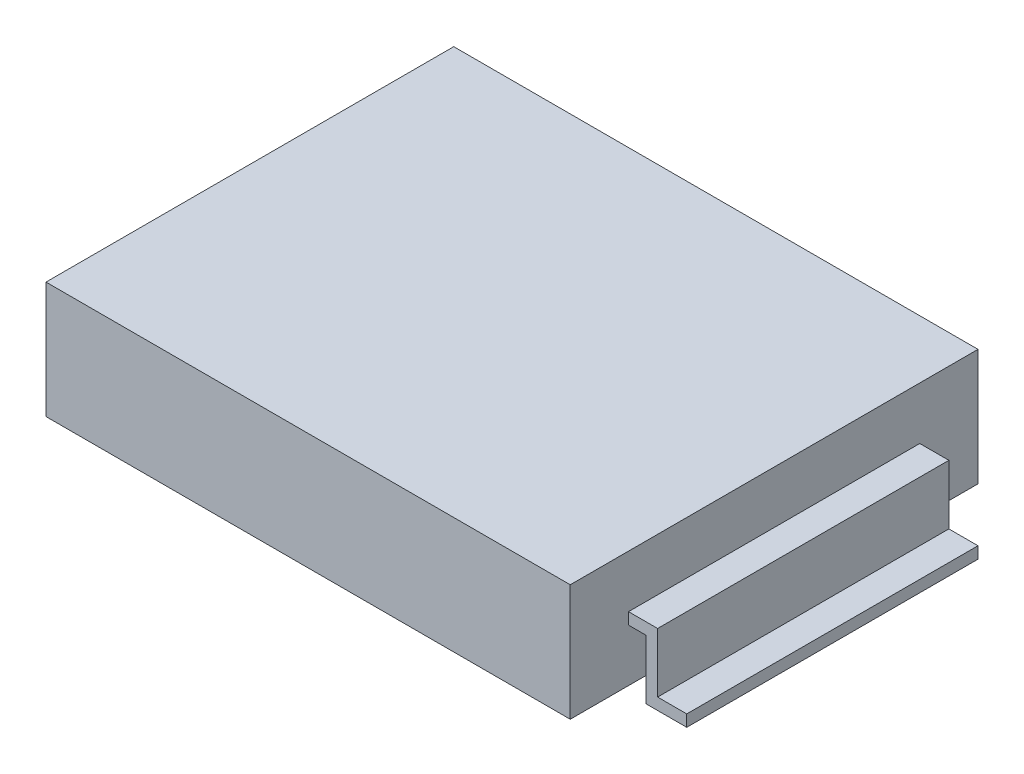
SolidWorks part; units mm, degrees
ref_plane "Front Plane" through (0, 0, 0) normal (0, 0, 1) x (1, 0, 0)
ref_plane "Top Plane" through (0, 0, 0) normal (0, 1, 0) x (1, 0, 0)
ref_plane "Right Plane" through (0, 0, 0) normal (1, 0, 0) x (0, 0, -1)
sketch "Sketch1" plane through (0, 0, 0) normal (0, 1, 0) x (1, 0, 0)
  line L0 (0, 6.8835) -> (0, -6.8835) construction
  line L1 (-5.5575, 0) -> (5.5575, 0) construction
  line L3 (-2.25, 1.75) -> (2.25, 1.75)
  line L4 (-2.25, 1.75) -> (-2.25, -1.75)
  line L5 (-2.25, -1.75) -> (2.25, -1.75)
  line L6 (2.25, 1.75) -> (2.25, -1.75)
  dimension "D1" = 4.5
  dimension "D2" = 3.5
extrude "Extrude1" add sketch "Sketch1" along normal mid plane 1
sketch "Sketch4" plane through (0, 0, 0) normal (0, 0, 1) x (1, 0, 0)
  line L0 (0, 1.2724) -> (0, -0.9364) construction
  line L1 (-2.25, 1.8525) -> (-2.25, -1.3157) construction
  line L2 (-2.25, 0.5) -> (-2.25, -0.5) construction
  line L3 (0, 0) -> (-6.2695, 0) construction
  line L4 (-2.75, 1.2724) -> (-2.75, -1.1019) construction
  line L5 (-2.25, 0) -> (-2.45, 0)
  line L6 (-2.45, 0) -> (-2.45, -0.51)
  line L7 (-2.45, -0.51) -> (-2.75, -0.51)
  line L9 (-2.25, -0.5) -> (2.25, -0.5) construction
  point P19 (-2.45, 0)
  point P22 (-2.45, -0.51)
  dimension "D1" = 0.5
  dimension "D2" = 0.01
  dimension "D3" = 0.3
  dimension "D4" = 0.2
extrude "Extrude-Thin1" add sketch "Sketch4" along normal mid plane 2.5 thin
mirror "Mirror1" about plane through (0, 0, 0) normal (1, 0, 0) of "Extrude-Thin1"
